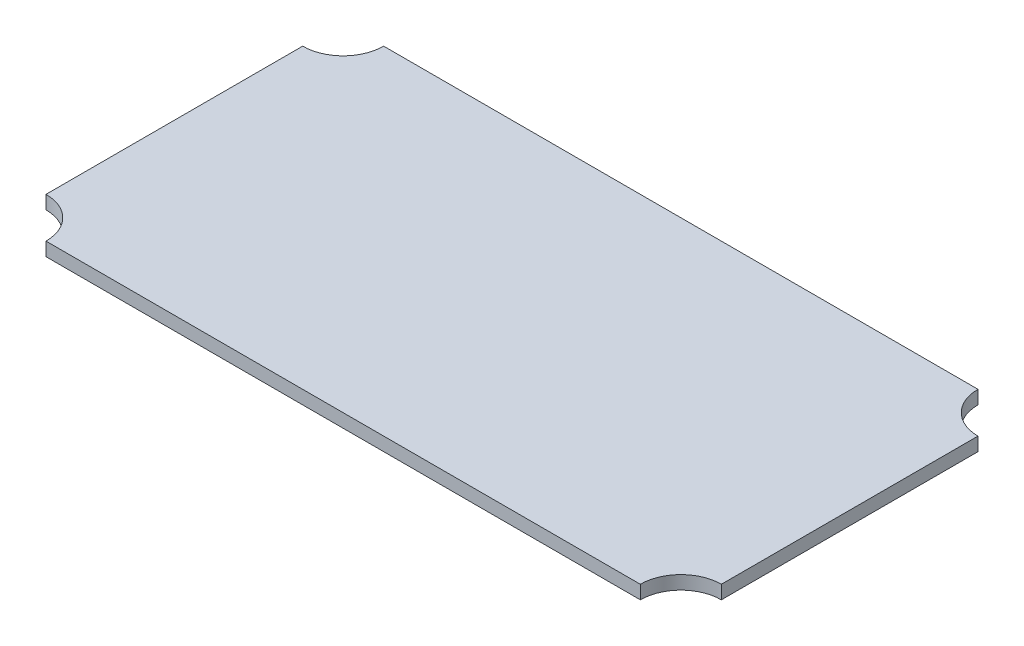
SolidWorks part; units mm, degrees
ref_plane "Ebene vorne" through (0, 0, 0) normal (0, 0, 1) x (1, 0, 0)
ref_plane "Ebene oben" through (0, 0, 0) normal (0, 1, 0) x (1, 0, 0)
ref_plane "Ebene rechts" through (0, 0, 0) normal (1, 0, 0) x (0, 0, -1)
sketch "Skizze1" plane through (0, 0, 0) normal (0, 1, 0) x (1, 0, 0)
  line L0 (-250, -125) -> (250, 125) construction
  line L1 (-250, -125) -> (250, -125)
  line L2 (-250, -125) -> (-250, 125)
  line L3 (-250, 125) -> (250, 125)
  line L4 (250, -125) -> (250, 125)
  dimension "D1" = 500
  dimension "D2" = 250
extrude "Linear austragen1" add sketch "Skizze1" along normal mid plane 10
sketch "Skizze2" plane through (0, 5, 0) normal (0, 1, 0) x (-1, 0, 0)
  circle A0 centre (250, 125) radius 30
  circle A1 centre (250, -125) radius 30
  circle A2 centre (-250, -125) radius 30
  circle A3 centre (-250, 125) radius 30
  dimension "D1" = 30
extrude "Ausklinkung" cut sketch "Skizze2" against normal through all
